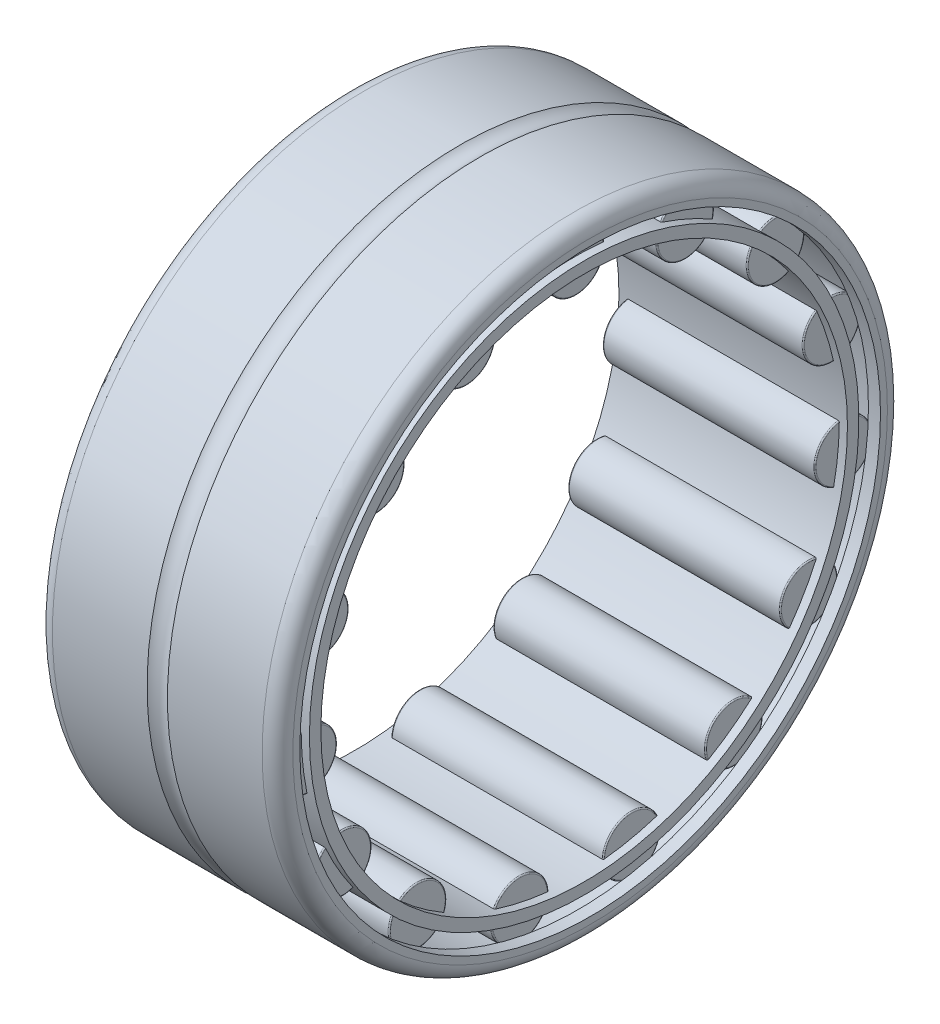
SolidWorks part; units mm, degrees
ref_plane "Plane1" through (0, 0, 0) normal (0, 0, 1) x (1, 0, 0)
ref_plane "Plane2" through (0, 0, 0) normal (0, 1, 0) x (1, 0, 0)
ref_plane "Plane3" through (0, 0, 0) normal (1, 0, 0) x (0, 0, -1)
other "Configuration Table"
sketch "Clipboard" plane through (0, 0, 0) normal (0, 0, 1) x (1, 0, 0)
  line L0 (-10, 0) -> (10, 0) construction
  line L1 (41.1529, 1.4371) -> (62.7517, -4.3503)
  line L2 (41.1529, 1.4371) -> (75.4583, 10.6292)
  line L3 (41.1529, 1.4371) -> (62.7517, -4.3503)
  line L4 (41.1529, 1.4371) -> (-22.3471, -0.7804)
sketch "InnRacSke" plane through (0, 0, 0) normal (0, 0, 1) x (1, 0, 0)
  line L0 (-14.2875, 38.3286) -> (-15.875, 38.3286)
  line L1 (-15.875, 38.3286) -> (-15.875, 39.243)
  line L2 (-13.843, 41.275) -> (-1.344, 41.275)
  line L3 (1.344, 41.275) -> (13.843, 41.275)
  line L4 (15.875, 39.243) -> (15.875, 38.3286)
  line L5 (15.875, 38.3286) -> (14.2875, 38.3286)
  line L6 (14.2875, 38.3286) -> (14.2875, 39.2811)
  line L7 (14.2875, 39.2811) -> (-14.2875, 39.2811)
  line L8 (-14.2875, 39.2811) -> (-14.2875, 38.3286)
  line L9 (-31.75, 0) -> (31.75, 0) construction
  arc A0 (-15.875, 39.243) -> (-13.843, 41.275) centre (-13.843, 39.243) cw
  arc A1 (-1.344, 41.275) -> (1.344, 41.275) centre (0, 42.799) ccw
  arc A2 (13.843, 41.275) -> (15.875, 39.243) centre (13.843, 39.243) cw
revolve "Race" add sketch "InnRacSke" angle 360 about L9
sketch "RolDetSke" plane through (0, 0, 0) normal (0, 0, 1) x (1, 0, 0)
  line L0 (-14.0018, 39.1427) -> (-14.0017, 35.5155)
  line L1 (-14.0017, 35.5155) -> (14.0017, 35.5155)
  line L2 (14.0017, 35.5155) -> (14.0018, 39.1427)
  line L3 (13.8506, 39.2938) -> (-13.8506, 39.2938)
  line L4 (-28.575, 35.5155) -> (28.575, 35.5155) construction
  arc A0 (14.0018, 39.1427) -> (13.8506, 39.2938) centre (13.8506, 39.1427) ccw
  arc A1 (-13.8506, 39.2938) -> (-14.0018, 39.1427) centre (-13.8506, 39.1427) ccw
revolve "RollerDetailed" add sketch "RolDetSke" angle 360 about L4
ref_axis "Axis1" through (-50, 0, 0) along (1, 0, 0)
sketch "CagSpiSke" plane through (0, 0, 0) normal (0, 0, 1) x (1, 0, 0)
  line L0 (15.0812, 34.7599) -> (15.0812, 36.2712)
  line L1 (15.0812, 36.2712) -> (-15.0813, 36.2712)
  line L2 (-15.0813, 36.2712) -> (-15.0813, 34.7599)
  line L3 (-15.0813, 34.7599) -> (15.0812, 34.7599)
  line L4 (-31.75, 0) -> (31.75, 0) construction
revolve "CageSpine" add sketch "CagSpiSke" angle 360 about L4
pattern_circular "RollersDetailed" count 15 every 24 about axis through (-50, 0, 0) along (1, 0, 0) of "RollerDetailed"
sketch "RolSimSke" plane through (0, 0, 0) normal (0, 0, 1) x (1, 0, 0)
  line L0 (-25.4, 0) -> (25.4, 0) construction
  line L2 (-13.8506, 39.3065) -> (13.8506, 39.3065)
  line L3 (-14.0018, 39.1554) -> (-14.0018, 31.9011)
  line L4 (-13.8506, 31.75) -> (13.8506, 31.75)
  line L5 (14.0017, 39.1554) -> (14.0017, 31.9011)
  arc A0 (-14.0018, 31.9011) -> (-13.8506, 31.75) centre (-13.8506, 31.9011) ccw
  arc A1 (-13.8506, 39.3065) -> (-14.0018, 39.1554) centre (-13.8506, 39.1554) ccw
  arc A2 (14.0017, 39.1554) -> (13.8506, 39.3065) centre (13.8506, 39.1554) ccw
  arc A3 (13.8506, 31.75) -> (14.0017, 31.9011) centre (13.8506, 31.9011) ccw
  point P10 (-14.0018, 31.75)
  point P15 (14.0017, 39.3065)
  point P18 (14.0017, 31.75)
revolve "RollersSimplified" [suppressed] add sketch "RolSimSke" angle 360 about L0
equation "\"BallCLRad@Clipboard\" =  ( \"D1@InnRacSke\" + \"Bore@Clipboard\" )  / 4"
equation "\"RollerCLRad@RolDetSke\" = \"BallCLRad@Clipboard\""
equation "\"offset@InnRacSke\" = \"radius@InnRacSke\" * .75"
equation "\"halfCyl@InnRacSke\" = \"Cyl_Len@InnRacSke\" / 2"
equation "\"Roller_diameter@RolDetSke\" =  ( \"D1@InnRacSke\" - \"Bore@Clipboard\" )  / 2 + .001"
equation "\"Roller_radius@RolDetSke\" = \"Roller_diameter@RolDetSke\" / 50"
equation "\"Roller_length@RolDetSke\" = \"Cyl_Len@InnRacSke\" * .98"
equation "\"halfLength@RolDetSke\" = \"Roller_length@RolDetSke\" / 2"
equation "\"Cage_width@CagSpiSke\" =  ( \"Cyl_Len@InnRacSke\" + \"Width@InnRacSke\" )  / 2"
equation "\"halfWidth@CagSpiSke\" = \"Cage_width@CagSpiSke\" / 2"
equation "\"Cage_thickness@CagSpiSke\"  = \"Roller_diameter@RolDetSke\" / 5"
equation "\"D2@CagSpiSke\" =  \"RollerCLRad@RolDetSke\" * 2 - \"Cage_thickness@CagSpiSke\""
equation "\"Roller_length@RolSimSke\" = \"Cyl_Len@InnRacSke\" * .98"
equation "\"halfWidth@RolSimSke\" = \"Roller_length@RolSimSke\" / 2"
equation "\"D1@RolSimSke\" = \"Roller_radius@RolDetSke\""
equation "\"Roller_diameter@RolSimSke\" =  ( \"D1@InnRacSke\" - \"Bore@Clipboard\" )  / 2 + .001"
equation "\"Max_count@Clipboard\" = int( 3.14159265 / atn(( \"Roller_diameter@RolDetSke\" / 2) / sqr( \"RollerCLRad@RolDetSke\"  *  \"RollerCLRad@RolDetSke\" - ( \"Roller_diameter@RolDetSke\" / 2) *  ( \"Roller_diameter@R"
equation "\"Max_count@Clipboard\" = ((sgn( \"Max_count@Clipboard\" - \"Count@Clipboard\" )-1)*( \"Max_count@Clipboard\" - \"Count@Clipboard\" ))/-2+ \"Count@Clipboard\""
equation "\"Count@RollersDetailed\" = int( \"Show_count@Clipboard\" ) "
equation "\"Count@RollersDetailed\" = ((sgn( \"Count@RollersDetailed\" - \"Max_count@Clipboard\" )-1)*( \"Count@RollersDetailed\" - \"Max_count@Clipboard\" ))/-2+ \"Max_count@Clipboard\""
equation "\"Count@RollersDetailed\" = ((sgn( \"Count@RollersDetailed\" - \"Min_count@Clipboard\" )+1)*( \"Count@RollersDetailed\" - \"Min_count@Clipboard\"))/2 +\"Min_count@Clipboard\""
equation "\"Angle@RollersDetailed\" = 360.0 / \"Max_count@Clipboard\""
equation "\"Angle@CageSpine\" =  \"Angle@RollersDetailed\" * ( \"Count@RollersDetailed\" -1 + int( \"Count@RollersDetailed\" / \"Max_count@Clipboard\" ) )  + 0.001 -  int( \"Count@RollersDetailed\" / \"Max_count@Clipboard\" "
equation "\"Angle@CageSpine\" =  \"Angle@CageSpine\" * int( \"Min_count@Clipboard\" / 2) + int(1 / \"Min_count@Clipboard\")  * 0.001"
equation "\"Bore@RolSimSke\" = \"Bore@Clipboard\""
